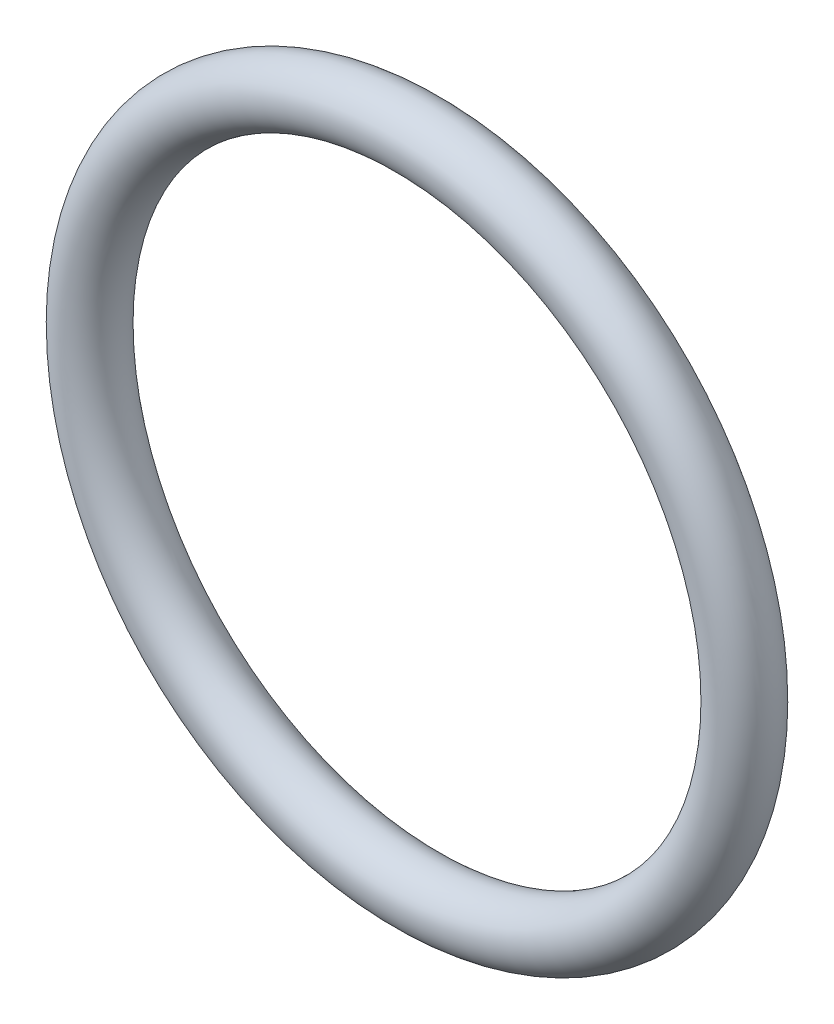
SolidWorks part; units mm, degrees
ref_plane "Front" through (0, 0, 0) normal (0, 0, 1) x (1, 0, 0)
ref_plane "Top" through (0, 0, 0) normal (0, 1, 0) x (1, 0, 0)
ref_plane "Right" through (0, 0, 0) normal (1, 0, 0) x (0, 0, -1)
sketch "Sketch1" plane through (0, 0, 0) normal (1, 0, 0) x (0, -1, 0)
  line L0 (0, -0.889) -> (0, 0.889) construction
  line L2 (-11.3995, 0) -> (11.3995, 0) construction
  line L3 (-8.5852, 0) -> (8.5852, 0) construction
  circle A0 centre (9.4742, 0) radius 0.889
  point P9 (8.5852, 0)
  point P10 (10.3632, 0)
  point P13 (9.4742, 0.889)
  point P14 (9.4742, -0.889)
  dimension "Width" = 1.778
  dimension "ID" = 17.1704
revolve "Revolve1" add sketch "Sketch1" angle 360 about L0
